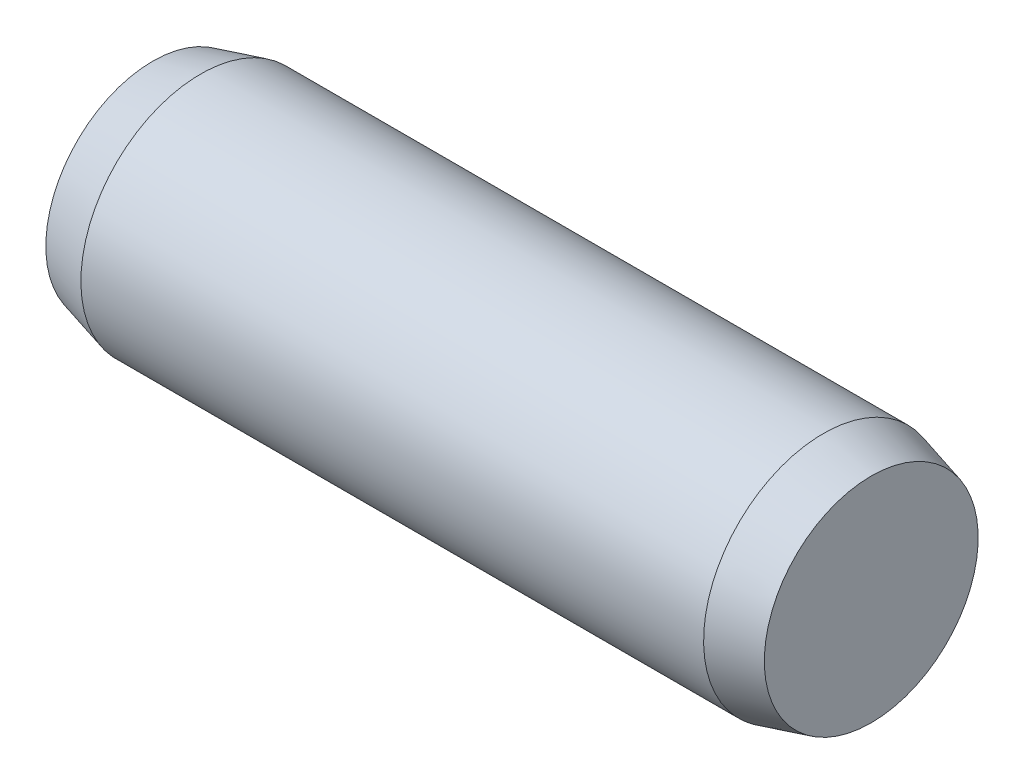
SolidWorks part; units mm, degrees
ref_plane "Plane1" through (0, 0, 0) normal (0, 0, 1) x (1, 0, 0)
ref_plane "Plane2" through (0, 0, 0) normal (0, 1, 0) x (1, 0, 0)
ref_plane "Plane3" through (0, 0, 0) normal (1, 0, 0) x (0, 0, -1)
other "Configuration Table"
sketch "BodySke" plane through (0, 0, 0) normal (0, 0, 1) x (1, 0, 0)
  line L0 (0, 0) -> (40.9091, 0) construction
  line L1 (28, 5) -> (30, 4.4641)
  line L2 (2, 5) -> (28, 5)
  line L3 (30, 4.4641) -> (30, 0)
  line L4 (0, 0) -> (30, 0)
  line L5 (2, 5) -> (0, 4.4641)
  line L6 (0, 4.4641) -> (0, 0)
  dimension "D1" = 15
  dimension "Diameter" = 10
  dimension "Length" = 30
  dimension "Chamfer_len" = 2
revolve "Body" add sketch "BodySke" angle 360 about L0
